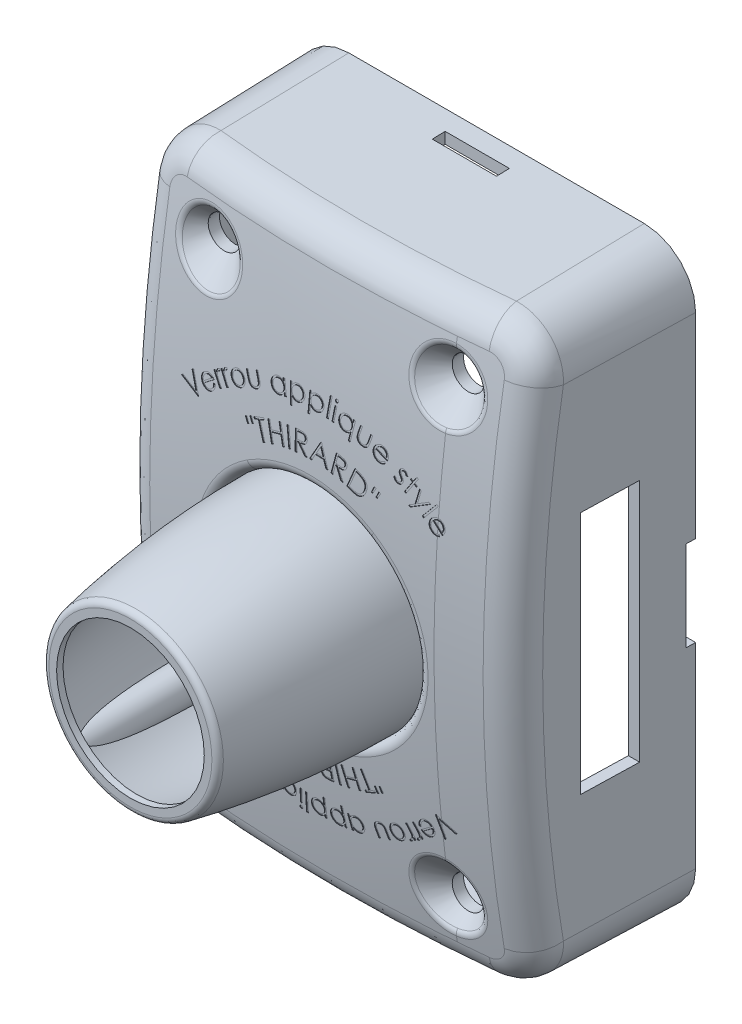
SolidWorks part; units mm, degrees
ref_plane "Plan de face" through (0, 0, 0) normal (0, 0, 1) x (1, 0, 0)
ref_plane "Plan de dessus" through (0, 0, 0) normal (0, 1, 0) x (1, 0, 0)
ref_plane "Plan de droite" through (0, 0, 0) normal (1, 0, 0) x (0, 0, -1)
sketch "Esquisse1" plane through (0, 0, 0) normal (0, 0, 1) x (1, 0, 0)
  line L0 (-31, 45.5) -> (31, -45.5) construction
  line L1 (-23, 45.5) -> (23, 45.5)
  line L2 (-31, 37.5) -> (-31, -37.5)
  line L3 (-23, -45.5) -> (23, -45.5)
  line L4 (31, 37.5) -> (31, -37.5)
  arc A0 (-31, -37.5) -> (-23, -45.5) centre (-23, -37.5) ccw
  arc A1 (23, -45.5) -> (31, -37.5) centre (23, -37.5) ccw
  arc A2 (23, 45.5) -> (31, 37.5) centre (23, 37.5) cw
  arc A3 (-23, 45.5) -> (-31, 37.5) centre (-23, 37.5) ccw
  dimension "D3" = 8
  dimension "D1" = 62
  dimension "D2" = 91
extrude "Boss.-Extru.1" add sketch "Esquisse1" along normal blind 35 draft 1.5
sketch "Esquisse2" plane through (0, 0, 0) normal (1, 0, 0) x (0, 0, -1)
  line L0 (0, 0) -> (-29.5, 0) construction
  line L2 (0, 45.5) -> (-25, 45.5) construction
  line L3 (0, -45.5) -> (-25, -45.5) construction
  line L4 (-17.0584, 75) -> (-37.1818, 75)
  line L5 (-37.1818, 75) -> (-37.1818, 0)
  line L6 (-37.1818, 0) -> (-29.5, 0)
  line L7 (0, 37.5) -> (0, -37.5) construction
  arc A0 (-25, 45.5) -> (-29.5, 0) centre (202.7778, 0) ccw
  arc A1 (-25, 45.5) -> (-17.0584, 75) centre (202.7778, 0) cw
  dimension "D4" = 29.5
  dimension "D1" = 25
  dimension "D2" = 7.6818
  dimension "D3" = 150
revolve "Enlèvement de matière-Révolution1" cut sketch "Esquisse2" angle 360 about L0
ref_plane "Plan1" through (0, 0, 27.5) normal (0, 0, -1) x (-1, 0, 0)
sketch "Esquisse3" plane through (0, 0, 27.5) normal (0, 0, -1) x (-1, 0, 0)
  line L0 (0, 0) -> (0, -3.5) construction
  circle A0 centre (0, -3.5) radius 16.5
  dimension "D1" = 33
  dimension "D2" = 3.5
extrude "Enlèv. mat.-Extru.2" cut sketch "Esquisse3" against normal through all
fillet "Congé2" radius 1.5 1 edges at (14.0372, 5.1721, 29.0178)
fillet "Congé3" radius 5 8 edges at (-27.5358, -43.3189, 23.7575) (0, -44.8419, 25.1305) (28.7667, -42.0988, 23.8345) (30.2794, 0, 27.518) (27.5358, 43.3189, 23.7575) (0, 44.8419, 25.1305) (-28.7667, 42.0988, 23.8345) (-30.2794, 0, 27.518)
ref_plane "Plan2" through (19, 0, 0) normal (1, 0, 0) x (0, 0, -1)
sketch "Esquisse4" plane through (19, 0, 0) normal (1, 0, 0) x (0, 0, -1)
  line L0 (-33.1168, 35) -> (9.8789, 35) construction
  dimension "D1" = 35
sketch "Esquisse5" plane through (19, 0, 0) normal (1, 0, 0) x (0, 0, -1)
  line L0 (0, 35) -> (-35.6546, 35) construction
  line L1 (0, -37.5) -> (0, 37.5) construction
  line L2 (-32.0212, 23.8768) -> (-23.398, 32.5)
  line L3 (-23.398, 32.5) -> (-23.398, 35)
  line L4 (-23.398, 35) -> (-32.0212, 35)
  line L6 (-32.0212, 35) -> (-32.0212, 23.8768)
  arc A0 (-25.0891, 40.8491) -> (-25.0891, -40.8491) centre (202.7778, 0) ccw construction
  arc A1 (-25.0891, 40.8491) -> (-25.0891, -40.8491) centre (202.7778, 0) ccw construction
  point P10 (-26.898, 29)
  dimension "D1" = 35
  dimension "D2" = 45
  dimension "D3" = 5
  dimension "D4" = 12
  dimension "D5" = 8.6232
revolve "Enlèvement de matière-Révolution2" cut sketch "Esquisse5" angle 360 about L0
mirror "Symétrie1" about plane through (0, 0, 0) normal (1, 0, 0) of "Enlèvement de matière-Révolution2"
mirror "Symétrie2" about plane through (0, 0, 0) normal (0, 1, 0) of "Symétrie1", "Enlèvement de matière-Révolution2"
fillet "Congé4" radius 1 6 edges at (13.3759, -34.2044, 26.5781) (23.6923, -35.1849, 25.594) (23.7298, 33.6151, 25.8264) (13.3798, 33.9439, 26.6166) (-20.8687, -38.9411, 25.2596) (-22.835, 37.264, 25.3514)
shell "Coque1" thickness 1.75
sketch "Esquisse6" plane through (0, 0, 0) normal (0, 0, 1) x (1, 0, 0)
  line L0 (0, 0) -> (0, 7.5) construction
  line L1 (-7, -7.5) -> (7, -7.5) construction
  line L2 (0, 0) -> (0, -7.5) construction
  circle A0 centre (-19, 35) radius 2.5 construction
  circle A1 centre (19, 35) radius 2.5 construction
  circle A2 centre (-19, -35) radius 2.5 construction
  circle A3 centre (19, -35) radius 2.5 construction
  circle A4 centre (-19, 35) radius 2.5
  circle A5 centre (19, 35) radius 2.5
  circle A6 centre (-19, -35) radius 2.5
  circle A7 centre (19, -35) radius 2.5
  arc A8 (-2.9394, 6.9) -> (2.9394, 6.9) centre (0, 0) ccw
  arc A9 (2.9394, 6.9) -> (-2.9394, 6.9) centre (0, 7.5) ccw
  circle A10 centre (-7, -7.5) radius 1.75
  circle A11 centre (7, -7.5) radius 1.75
  dimension "D1" = 15
  dimension "D2" = 6
  dimension "D6" = 3.5
  dimension "D3" = 7.5
  dimension "D4" = 7.5
  dimension "D5" = 14
extrude "Enlèv. mat.-Extru.4" cut sketch "Esquisse6" along normal through all
chamfer "Chanfrein1" distance 1 angle 45 2 edges at (-8.75, -7.5, 25.75) (5.25, -7.5, 25.75)
sketch "Esquisse7" plane through (0, 0, 0) normal (1, 0, 0) x (0, 0, -1)
  line L0 (0, 0) -> (-8.5, 0) construction
  line L1 (-17.5, 19) -> (-8.5, 19)
  line L2 (-17.5, 19) -> (-17.5, -19)
  line L3 (-17.5, -19) -> (-8.5, -19)
  line L4 (-8.5, 19) -> (-8.5, -19)
  line L5 (0, -37.5) -> (0, 37.5) construction
  line L7 (0, 7) -> (-1.5, 7)
  line L8 (0, 7) -> (0, -7)
  line L9 (0, -7) -> (-1.5, -7)
  line L10 (-1.5, 7) -> (-1.5, -7)
  dimension "D1" = 9
  dimension "D2" = 38
  dimension "D3" = 8.5
  dimension "D4" = 1.5
  dimension "D5" = 14
extrude "Enlèv. mat.-Extru.5" cut sketch "Esquisse7" against normal through all and the other way through all
sketch "Esquisse8" plane through (0, 0, 0) normal (0, 1, 0) x (1, 0, 0)
  line L0 (23, 0) -> (-23, 0) construction
  line L1 (-5, -3) -> (5, -3)
  line L2 (-5, -3) -> (-5, -5)
  line L3 (-5, -5) -> (5, -5)
  line L4 (5, -3) -> (5, -5)
  line L5 (0, 0) -> (0, -7.7473) construction
  dimension "D1" = 3
  dimension "D2" = 2
  dimension "D3" = 10
extrude "Enlèv. mat.-Extru.6" cut sketch "Esquisse8" against normal through all and the other way through all
sketch "Esquisse9" plane through (0, 0, 27.5) normal (0, 0, 1) x (1, 0, 0)
  line L0 (10.253, 6.753) -> (-10.253, -13.753) construction
  line L1 (0, -3.5) -> (14.5, -3.5) construction
  circle A0 centre (0, -3.5) radius 14.5 construction
  circle A1 centre (0, -3.5) radius 16.5 construction
  circle A2 centre (10.253, 6.753) radius 1.5
  circle A3 centre (-10.253, -13.753) radius 1.5
  dimension "D1" = 29
  dimension "D3" = 3
  dimension "D2" = 45
extrude "Enlèv. mat.-Extru.7" cut sketch "Esquisse9" against normal through all
ref_plane "Plan3" through (0, -3.5, 0) normal (0, 1, 0) x (-1, 0, 0)
sketch "Esquisse10" plane through (0, -3.5, 0) normal (0, 1, 0) x (-1, 0, 0)
  line L1 (-16.5, 27.5) -> (-16.5, 57) construction
  line L2 (-14.7, 27.5) -> (-16.5, 27.5)
  line L3 (16.5, 27.5) -> (-16.5, 27.5) construction
  line L4 (-16.5, 57) -> (0, 57) construction
  line L5 (0, 57) -> (0, 27.5) construction
  line L6 (-12.6823, 57) -> (-11.5, 57)
  line L7 (0, 27.5) -> (-14.5, 27.5) construction
  line L8 (-11.5, 57) -> (-11.5, 56)
  line L9 (-11.5, 56) -> (-11.8664, 56)
  arc A0 (-13.6629, 56.1958) -> (-16.5, 27.5) centre (130.0417, 27.5) ccw
  arc A1 (-11.8664, 56) -> (-14.7, 27.5) centre (130.0417, 27.5) ccw
  arc A2 (-12.6823, 57) -> (-13.6629, 56.1958) centre (-12.6823, 56) ccw
  point P22 (-13.5, 57)
  dimension "D6" = 1
  dimension "D1" = 29.5
  dimension "D2" = 27
  dimension "D3" = 23
  dimension "D4" = 1
  dimension "D5" = 1.8
revolve "Révolution1" add sketch "Esquisse10" angle 360 about L5
sketch "Esquisse11" plane through (0, 0, 27.5) normal (0, 0, -1) x (-1, 0, 0)
  line L0 (-10.253, -13.753) -> (10.253, 6.753) construction
  line L1 (-10.253, 6.753) -> (10.253, -13.753) construction
  arc A0 (13.0015, -13.6593) -> (10.1593, -16.5015) centre (10.253, -13.753) ccw
  arc A1 (-13.0015, 6.6593) -> (-10.1593, 9.5015) centre (-10.253, 6.753) ccw
  arc A2 (-10.1593, -16.5015) -> (-13.0015, -13.6593) centre (-10.253, -13.753) ccw
  arc A3 (10.1593, 9.5015) -> (13.0015, 6.6593) centre (10.253, 6.753) ccw
  circle A5 centre (0, -3.5) radius 11.75 construction
  circle A6 centre (0, -3.5) radius 16.5 construction
  arc A7 (-10.1593, 9.5015) -> (-13.0015, 6.6593) centre (0, -3.5) ccw
  arc A8 (-13.0015, -13.6593) -> (-10.1593, -16.5015) centre (0, -3.5) ccw
  arc A9 (13.0015, 6.6593) -> (10.1593, 9.5015) centre (0, -3.5) ccw
  arc A10 (10.1593, -16.5015) -> (13.0015, -13.6593) centre (0, -3.5) ccw
  dimension "D1" = 23.5
extrude "Boss.-Extru.2" add sketch "Esquisse11" against normal up to surface (29.5 mm away)
sketch "Esquisse12" plane through (0, 0, 27.5) normal (0, 0, -1) x (-1, 0, 0)
  circle A0 centre (-10.253, 6.753) radius 1.5 construction
  circle A1 centre (10.253, -13.753) radius 1.5 construction
  circle A2 centre (-10.253, 6.753) radius 1.5
  circle A3 centre (10.253, -13.753) radius 1.5
extrude "Boss.-Extru.3" add sketch "Esquisse12" along normal blind 2
sketch "Esquisse13" plane through (0, 0, 25.5) normal (0, 0, -1) x (-1, 0, 0)
  circle A0 centre (-10.253, 6.753) radius 2.5
  circle A1 centre (10.253, -13.753) radius 2.5
  dimension "D1" = 5
extrude "Boss.-Extru.4" add sketch "Esquisse13" along normal blind 1.5
fillet "Congé5" radius 1.2 2 edges at (-12.753, -13.753, 24) (7.753, 6.753, 24)
sketch "Esquisse14" plane through (0, 0, 57) normal (0, 0, 1) x (1, 0, 0)
  arc A0 (25.9528, 1.8572) -> (-25.9528, 1.8572) centre (0, -3.5) ccw construction
  circle A1 centre (0, -3.5) radius 11.5 construction
  arc A2 (-25.9571, -8.8366) -> (25.9571, -8.8366) centre (0, -3.5) ccw construction
  ellipse E0 centre (-31.975, 0) end of major axis (-31.975, -230.0649) minor radius 6.0224 (-26.0368, -38.325) -> (-26.0368, 38.325) ccw construction
  ellipse E1 centre (31.975, 0) end of major axis (31.975, 230.0649) minor radius 6.0224 (26.0368, 38.325) -> (26.0368, -38.325) ccw construction
  ellipse E2 centre (-31.975, 0) end of major axis (-31.975, -230.0649) minor radius 6.0224 (-26.0368, -38.325) -> (-26.0368, 38.325) ccw construction
  ellipse E3 centre (31.975, 0) end of major axis (31.975, 230.0649) minor radius 6.0224 (26.0368, 38.325) -> (26.0368, -38.325) ccw construction
  text T0 "Verrou applique style  \"THIRARD\"" font "Century Gothic" height 3
  text T1 "Verrou applique style  \"THIRARD\"" font "Century Gothic" height 3
  dimension "D1" = 53
  dimension "D2" = 53
extrude "Enlèv. mat.-Extru.10" cut sketch "Esquisse14" against normal offset from surface (28.955 mm away) 0.1
